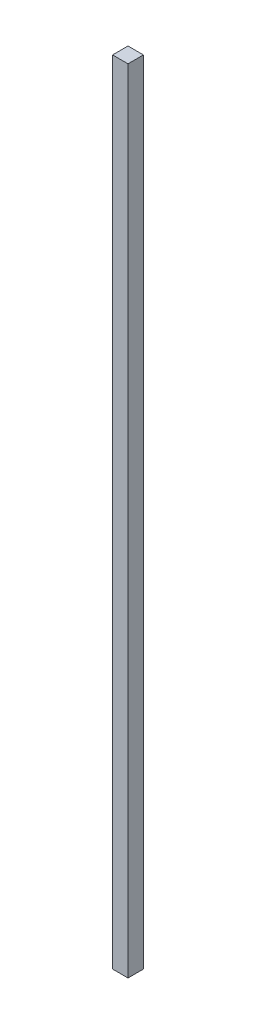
SolidWorks part; units mm, degrees
ref_plane "前视基准面" through (0, 0, 0) normal (0, 0, 1) x (1, 0, 0)
ref_plane "上视基准面" through (0, 0, 0) normal (0, 1, 0) x (1, 0, 0)
ref_plane "右视基准面" through (0, 0, 0) normal (1, 0, 0) x (0, 0, -1)
other "Configuration Table"
sketch "草图1" plane through (0, 0, 0) normal (0, 1, 0) x (1, 0, 0)
  line L1 (-30, 30) -> (30, 30)
  line L2 (-30, 30) -> (-30, -30)
  line L3 (-30, -30) -> (30, -30)
  line L4 (30, 30) -> (30, -30)
  line L5 (-30, 30) -> (30, -30) construction
  line L6 (-30, -30) -> (30, 30) construction
  point P0 (0, 0)
extrude "凸台-拉伸1" add sketch "草图1" along normal blind 3080
sketch "草图2" plane through (-30, 0, 0) normal (-1, 0, 0) x (0, 0, 1)
  line L0 (-30, 550) -> (30, 550)
  line L1 (-30, 3080) -> (-30, 0) construction
  line L2 (30, 3080) -> (30, 0) construction
  line L3 (-30, 1070) -> (30, 1070)
  line L4 (-30, 1590) -> (30, 1590)
  line L5 (-30, 1070) -> (30, 1070)
  line L6 (-30, 0) -> (30, 0) construction
  dimension "D1" = 550
  dimension "D2" = 520
  dimension "D3" = 520
